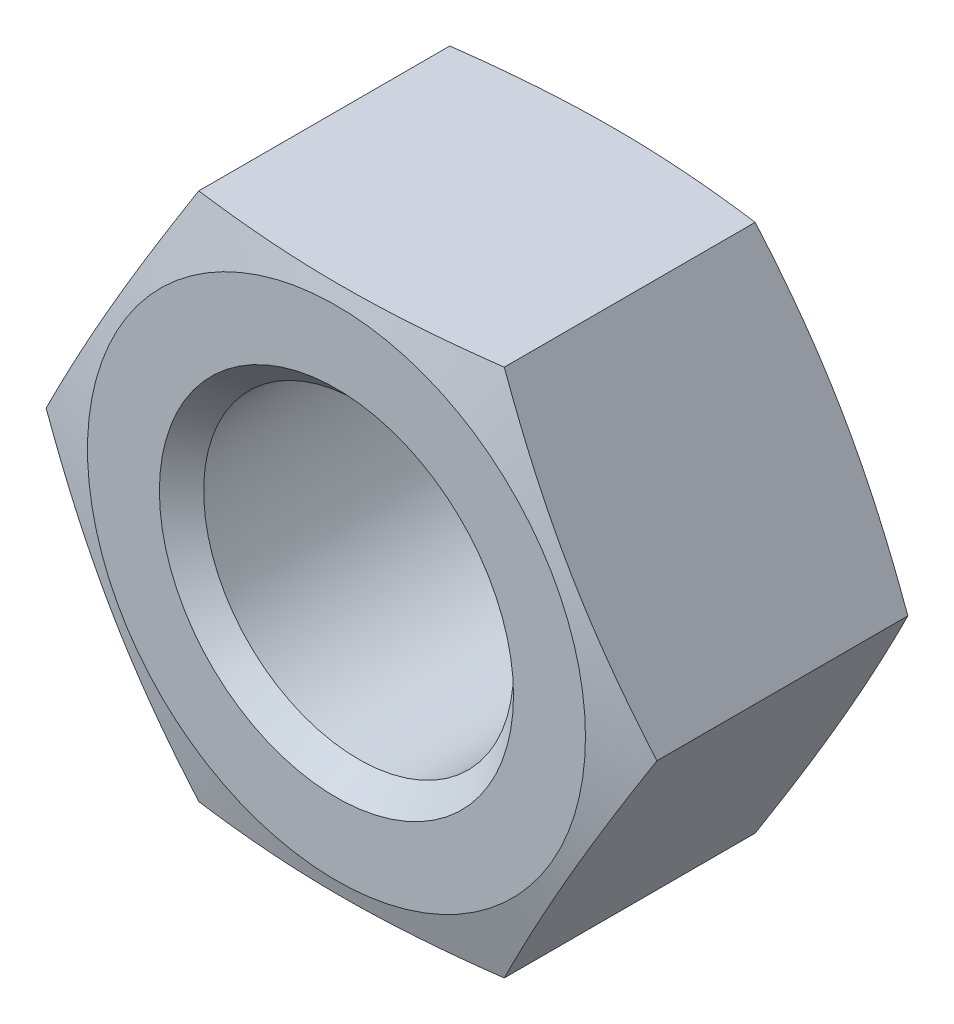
SolidWorks part; units mm, degrees
ref_plane "Plan de face" through (0, 0, 0) normal (0, 0, 1) x (1, 0, 0)
ref_plane "Plan de dessus" through (0, 0, 0) normal (0, 1, 0) x (1, 0, 0)
ref_plane "Plan de droite" through (0, 0, 0) normal (1, 0, 0) x (0, 0, -1)
sketch "Esquisse1" plane through (0, 0, 0) normal (0, 0, 1) x (1, 0, 0)
  line L0 (55, 0) -> (-55, 0) construction
  line L1 (6.8993, -11.95) -> (13.7987, 0)
  line L2 (13.7987, 0) -> (6.8993, 11.95)
  line L3 (6.8993, 11.95) -> (-6.8993, 11.95)
  line L4 (-6.8993, 11.95) -> (-13.7987, 0)
  line L5 (-13.7987, 0) -> (-6.8993, -11.95)
  line L6 (-6.8993, -11.95) -> (6.8993, -11.95)
  circle A0 centre (0, 0) radius 11.95 construction
  dimension "D1" = 23.9
extrude "Boss.-Extru.1" add sketch "Esquisse1" along normal mid plane 12.7
hole_wizard "Trou taraudé M161" positions "Esquisse3" profile "Esquisse2" tap size "M16" standard "ISO"
sketch "Esquisse3" plane through (0, 0, 6.35) normal (0, 0, 1) x (1, 0, 0)
  point P0 (0, 0)
sketch "Esquisse2" plane through (0, 0, 6.35) normal (1, 0, 0) x (0, -1, 0)
  line L0 (0, 0) -> (0, 44.206)
  line L1 (0, 44.206) -> (7, 40)
  line L2 (7, 40) -> (7, 0)
  line L5 (7, 0) -> (0, 0)
  line L10 (0, 44.206) -> (-7, 40) construction
  line L11 (0, -6.35) -> (0, 107.95) construction
  dimension "Diamètre du trou pour taraudage" = 14
  dimension "Profondeur du trou pour taraudage" = 40
  dimension "Angle de pointe" = 118
sketch "Esquisse4" plane through (0, 0, 6.35) normal (0, 0, 1) x (1, 0, 0)
  circle A0 centre (0, 0) radius 11.25
  dimension "D1" = 22.5
extrude "Enlèv. mat.-Extru.1" cut sketch "Esquisse4" against normal blind 12.7 draft 75 flip side to cut
sketch "Esquisse5" plane through (0, 0, -6.35) normal (0, 0, -1) x (-1, 0, 0)
  circle A0 centre (0, 0) radius 11.25
  circle A1 centre (0, 0) radius 11.25 construction
extrude "Enlèv. mat.-Extru.2" cut sketch "Esquisse5" against normal blind 12.7 draft 75 flip side to cut
chamfer "Chanfrein1" distance 1 angle 45 2 edges at (7, 0, 6.35) (7, 0, -6.35)
